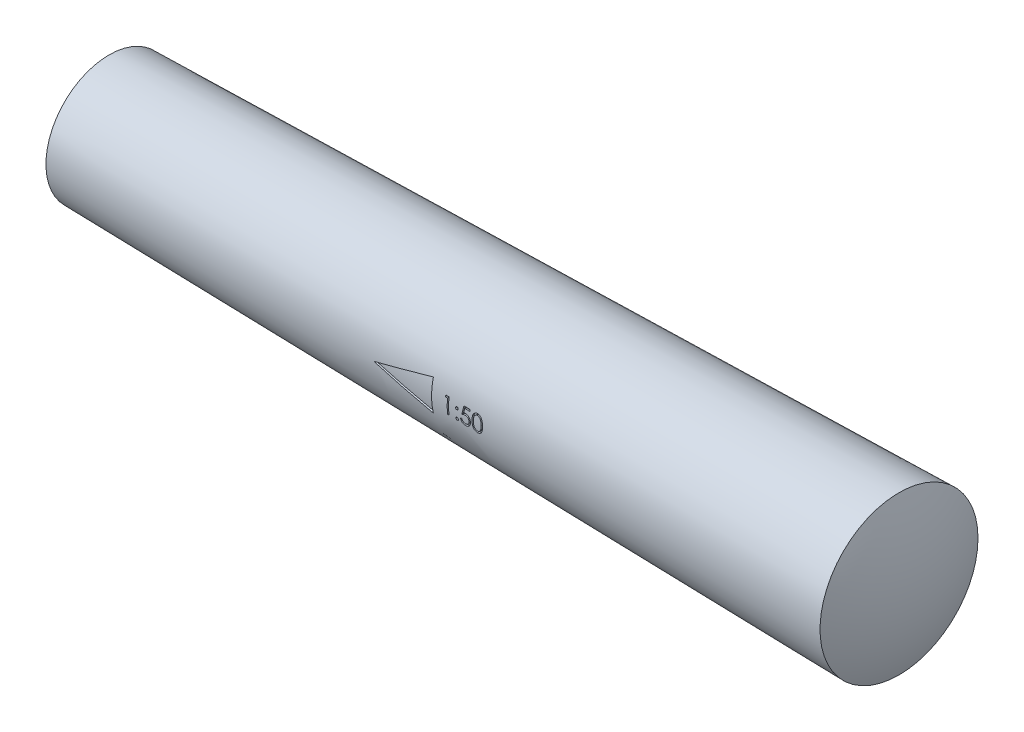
SolidWorks part; units mm, degrees
ref_plane "Front Plane" through (0, 0, 0) normal (0, 0, 1) x (1, 0, 0)
ref_plane "Top Plane" through (0, 0, 0) normal (0, 1, 0) x (1, 0, 0)
ref_plane "Right Plane" through (0, 0, 0) normal (1, 0, 0) x (0, 0, -1)
sketch "Sketch1" plane through (0, 0, 0) normal (1, 0, 0) x (0, 0, -1)
  circle A0 centre (0, 0) radius 4
  dimension "D1" = 8
extrude "Extrude1" add sketch "Sketch1" along normal mid plane 50
draft "Draft1" type of draft neutral plane draft angle 1.146 faces to draft 1 parameters "D1"=1.146
sketch "Sketch2" plane through (0, 0, 0) normal (0, 0, 1) x (1, 0, 0)
  line L0 (-25, 0) -> (-25, 4)
  line L1 (-25, 4) -> (-25, -4) construction
  line L2 (-25, 0) -> (-26, 0)
  line L3 (-26, 0) -> (-26, -4.5) construction
  line L4 (25, 0) -> (25, 5)
  line L5 (25, -5) -> (25, 5) construction
  line L6 (25, 0) -> (26, 0)
  line L7 (26, 0) -> (26, -4.5) construction
  line L8 (-25, -4) -> (25, -5) construction
  arc A0 (-26, 0) -> (-25, 4) centre (-17.5, 0) cw
  arc A1 (26, 0) -> (25, 5) centre (12.9998, 0) ccw
  point P14 (0, -4.5)
revolve "Revolve1" add sketch "Sketch2" angle 360 about L2
sketch "Sketch5" plane through (0, 0, 0) normal (0, 0, 1) x (1, 0, 0)
  line L0 (0, 4.5) -> (0, -4.5) construction
  line L1 (25, 5) -> (-25, 4) construction
  line L2 (-25, -4) -> (25, -5) construction
ref_plane "Plane2" through (0, 0, 0) normal (-0.02, 0, 0.9998) x (0.9998, 0, 0.02)
sketch "Sketch6" plane through (0, 0, 0) normal (-0.02, 0, 0.9998) x (0.9998, 0, 0.02)
  line L0 (0, 0) -> (0, 1)
  line L1 (0, 4.5) -> (0, -4.5) construction
  line L2 (0, 1) -> (-3.7321, 0)
  line L3 (-3.7321, 0) -> (0, -1)
  line L4 (0, -1) -> (0, 0)
  line L5 (0, -0.5) -> (4, -0.5) construction
  text T0 "1:50" font "Century Gothic" height 1
  dimension "D1" = 2
  dimension "D2" = 30
  dimension "D3" = 4
wrap "Wrap2" sketch "Sketch6" wrap type deboss source sketch "Sketch6" thickness 0.1 parameters "D1"=0.1
equation "\"D2@Sketch2\" = \"D1@Sketch2\""
